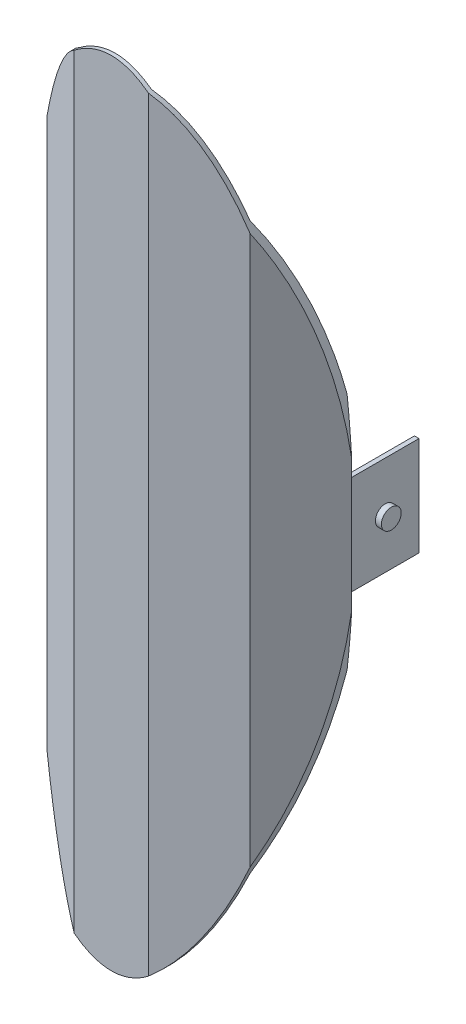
SolidWorks part; units mm, degrees
ref_plane "Alzado" through (0, 0, 0) normal (0, 0, 1) x (1, 0, 0)
ref_plane "Planta" through (0, 0, 0) normal (0, 1, 0) x (1, 0, 0)
ref_plane "Vista lateral" through (0, 0, 0) normal (1, 0, 0) x (0, 0, -1)
sketch "Croquis1" plane through (0, 0, 0) normal (0, 1, 0) x (1, 0, 0)
  line L0 (-67.6906, -18.7564) -> (-49.7795, -49.7795)
  line L7 (-70, -18.7564) -> (-51.2436, -51.2436)
  line L8 (-51.2436, -51.2436) -> (-18.7564, -70)
  line L9 (-18.7564, -70) -> (18.7564, -70)
  line L10 (18.7564, -70) -> (51.2436, -51.2436)
  line L11 (51.2436, -51.2436) -> (70, -18.7564)
  line L13 (70, 0) -> (70, 18.7564)
  line L14 (-70, 18.7564) -> (-70, 0)
  line L15 (-51.2436, 51.2436) -> (-60.6218, 35)
  line L16 (-18.7564, 70) -> (-35, 60.6218)
  line L17 (35, 60.6218) -> (18.7564, 70)
  line L18 (18.7564, 70) -> (0, 70)
  line L19 (60.6218, 35) -> (51.2436, 51.2436)
  line L20 (-49.7795, -49.7795) -> (-18.2205, -68)
  line L21 (-18.2205, -68) -> (18.2205, -68)
  line L22 (18.2205, -68) -> (49.7795, -49.7795)
  line L23 (49.7795, -49.7795) -> (67.6906, -18.7564)
  line L24 (-70, -18.7564) -> (-67.6906, -18.7564)
  line L25 (70, -18.7564) -> (67.6906, -18.7564)
  line L26 (49.7795, -49.7795) -> (68.2679, -17.7564) construction
  line L27 (-68.2679, -17.7564) -> (-49.7795, -49.7795) construction
  arc A0 (-60.6218, -35) -> (60.6218, -35) centre (0, 0) ccw construction
  dimension "D1" = 140
  dimension "D2" = 2
extrude "Saliente-Extruir1" add sketch "Croquis1" along normal mid plane 400
sketch "Croquis2" plane through (0, 0, 0) normal (0, 0, 1) x (1, 0, 0)
  line L0 (-18.7564, 200) -> (18.7564, 200) construction
  line L2 (-113.6974, -233.1319) -> (113.6974, -233.1319)
  line L3 (-113.6974, -233.1319) -> (-113.6974, 233.1319)
  line L4 (-113.6974, 233.1319) -> (113.6974, 233.1319)
  line L5 (113.6974, -233.1319) -> (113.6974, 233.1319)
  line L6 (-113.6974, -233.1319) -> (113.6974, 233.1319) construction
  line L7 (-113.6974, 233.1319) -> (113.6974, -233.1319) construction
  ellipse E0 centre (0, 0) end of major axis (0, 200) minor radius 71
  dimension "D1" = 142
  dimension "D2" = 71
extrude "Cortar-Extruir1" cut sketch "Croquis2" along normal blind 400
sketch "Croquis3" plane through (0, 0, 0) normal (0, 0, 1) x (1, 0, 0)
  line L0 (-70, 33.4489) -> (-70, -33.4489) construction
  line L1 (-67.6906, -25) -> (-70, -25)
  line L2 (-67.6906, -25) -> (-67.6906, 25)
  line L3 (-67.6906, 25) -> (-70, 25)
  line L4 (-70, -25) -> (-70, 25)
  line L5 (-67.6906, -25) -> (-70, 25) construction
  line L6 (-67.6906, 25) -> (-70, -25) construction
  line L7 (-67.6906, 60.349) -> (-67.6906, -60.349) construction
  point P0 (-68.8453, 0)
  dimension "D1" = 50
sketch "Croquis4" plane through (0, 0, 18.7564) normal (0, 0, -1) x (-1, 0, 0)
  line L1 (70, -25) -> (67.6906, -25)
  line L2 (70, -25) -> (70, 25)
  line L3 (70, 25) -> (67.6906, 25)
  line L4 (67.6906, -25) -> (67.6906, 25)
  line L5 (70, -25) -> (67.6906, 25) construction
  line L6 (70, 25) -> (67.6906, -25) construction
  line L8 (-67.6906, -25) -> (-70, -25)
  line L9 (-67.6906, -25) -> (-67.6906, 25)
  line L10 (-70, -25) -> (-70, 25)
  line L11 (-67.6906, 25) -> (-70, 25)
  line L12 (-67.6906, 60.349) -> (-67.6906, -60.349) construction
  point P0 (68.8453, 0)
  point P5 (-68.8185, 0)
  dimension "D1" = 50
extrude "Saliente-Extruir2" add sketch "Croquis4" along normal blind 34
sketch "Croquis5" plane through (-70, 0, 0) normal (-1, 0, 0) x (0, 0, 1)
  line L0 (-15.2436, -25) -> (-15.2436, 25) construction
  line L1 (-15.2436, 25) -> (18.7564, 25) construction
  circle A0 centre (1.7564, 0) radius 2
  dimension "D1" = 4
  dimension "D2" = 17
  dimension "D3" = 25
extrude "Cortar-Extruir2" cut sketch "Croquis5" against normal blind 172
sketch "Croquis6" plane through (-70, 0, 0) normal (-1, 0, 0) x (0, 0, 1)
  circle A0 centre (1.7564, 0) radius 5
extrude "Saliente-Extruir3" add sketch "Croquis6" along normal blind 3 separate body
mirror "Simetría2" about plane through (0, 0, 0) normal (1, 0, 0)
